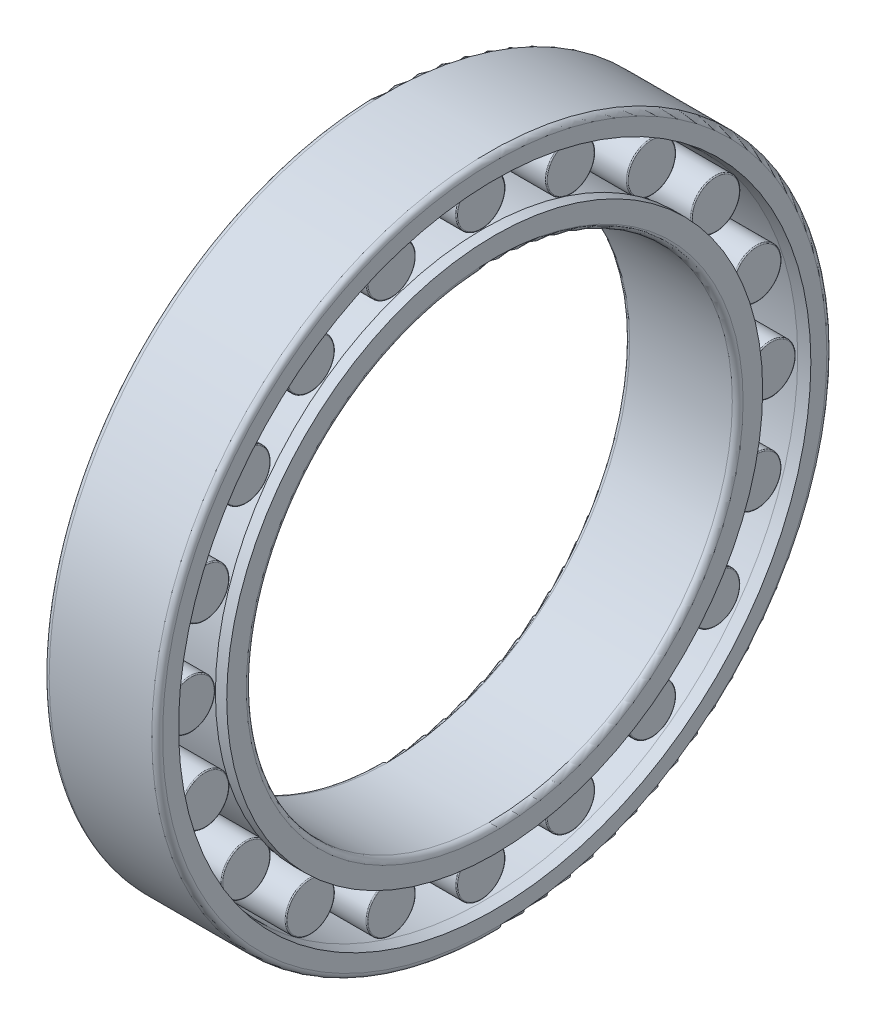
SolidWorks part; units mm, degrees
ref_plane "Plane1" through (0, 0, 0) normal (0, 0, 1) x (1, 0, 0)
ref_plane "Plane2" through (0, 0, 0) normal (0, 1, 0) x (1, 0, 0)
ref_plane "Plane3" through (0, 0, 0) normal (1, 0, 0) x (0, 0, -1)
other "Configuration Table"
sketch "Clipboard" plane through (0, 0, 0) normal (0, 0, 1) x (1, 0, 0)
  line L0 (-10, 0) -> (10, 0) construction
  line L1 (0, 0) -> (185.2698, -67.4327)
  line L2 (0, 0) -> (101.017, 36.7672)
  line L3 (0, 0) -> (218.798, -79.636)
  line L4 (0, 0) -> (-22.3471, -0.7804)
sketch "OutRacSke" plane through (0, 0, 0) normal (0, 0, 1) x (1, 0, 0)
  line L0 (16.8, 116.42) -> (21, 117.0867)
  line L1 (-21, 117.0867) -> (-21, 123)
  line L2 (-19, 125) -> (19, 125)
  line L3 (21, 123) -> (21, 117.0867)
  line L4 (-16.8, 116.42) -> (-21, 117.0867)
  line L6 (16.8, 116.42) -> (-16.8, 116.42)
  line L8 (-90, 0) -> (90, 0) construction
  arc A0 (-21, 123) -> (-19, 125) centre (-19, 123) cw
  arc A1 (19, 125) -> (21, 123) centre (19, 123) cw
revolve "OuterRace" add sketch "OutRacSke" angle 360 about L8
sketch "RolDetSke" plane through (0, 0, 0) normal (0, 0, 1) x (1, 0, 0)
  line L0 (-15.96, 116.1851) -> (-15.96, 107.5)
  line L1 (-15.96, 107.5) -> (15.96, 107.5)
  line L2 (15.96, 107.5) -> (15.96, 116.1851)
  line L3 (15.5981, 116.547) -> (-15.5981, 116.547)
  line L4 (-33.6, 107.5) -> (33.6, 107.5) construction
  arc A0 (15.96, 116.1851) -> (15.5981, 116.547) centre (15.5981, 116.1851) ccw
  arc A1 (-15.5981, 116.547) -> (-15.96, 116.1851) centre (-15.5981, 116.1851) ccw
revolve "RollerDetailed" add sketch "RolDetSke" angle 360 about L4
ref_axis "Axis1" through (-50, 0, 0) along (1, 0, 0)
sketch "RolSimSke" plane through (0, 101.6, 0) normal (0, 0, 1) x (1, 0, 0)
  line L0 (-15.96, 14.5851) -> (-15.96, -2.7851)
  line L1 (25.4, -101.6) -> (-25.4, -101.6) construction
  line L2 (15.96, -2.7851) -> (15.96, 14.5851)
  line L3 (15.5981, 14.947) -> (-15.5981, 14.947)
  line L5 (15.5981, -3.147) -> (-15.5981, -3.147)
  arc A0 (15.96, 14.5851) -> (15.5981, 14.947) centre (15.5981, 14.5851) ccw
  arc A1 (-15.5981, 14.947) -> (-15.96, 14.5851) centre (-15.5981, 14.5851) ccw
  arc A2 (15.96, -2.7851) -> (15.5981, -3.147) centre (15.5981, -2.7851) cw
  arc A3 (-15.5981, -3.147) -> (-15.96, -2.7851) centre (-15.5981, -2.7851) cw
revolve "RollersSimplified" [suppressed] add sketch "RolSimSke" angle 360 about L1
sketch "InsRacSke" plane through (0, 0, 0) normal (0, 0, 1) x (1, 0, 0)
  line L0 (16.8, 98.58) -> (16.8, 99.2467)
  line L1 (-21, 99.2467) -> (-21, 92)
  line L2 (-19, 90) -> (19, 90)
  line L3 (21, 92) -> (21, 99.2467)
  line L4 (16.8, 99.2467) -> (21, 99.2467)
  line L5 (16.8, 98.58) -> (-16.8, 98.58)
  line L6 (-90, 0) -> (90, 0) construction
  line L8 (-16.8, 98.58) -> (-16.8, 99.2467)
  line L9 (-16.8, 99.2467) -> (-21, 99.2467)
  arc A0 (-21, 92) -> (-19, 90) centre (-19, 92) ccw
  arc A1 (19, 90) -> (21, 92) centre (19, 92) ccw
revolve "InnerRace" add sketch "InsRacSke" angle 360 about L6
pattern_circular "RollersDetailed" count 20 every 18 about axis through (-50, 0, 0) along (1, 0, 0) of "RollerDetailed"
sketch "CagSpiSke" plane through (0, 0, 0) normal (0, 0, 1) x (1, 0, 0)
  line L0 (18.9, 105.2383) -> (18.9, 109.7618)
  line L1 (18.9, 109.7618) -> (-18.9, 109.7618)
  line L2 (-18.9, 109.7618) -> (-18.9, 105.2383)
  line L3 (-18.9, 105.2383) -> (18.9, 105.2383)
  line L4 (-90, 0) -> (90, 0) construction
revolve "CageSpine" [suppressed] add sketch "CagSpiSke" angle 360 about L4
equation "\"CLdia@Clipboard\" =  ( \"Race_OD@Clipboard\" + \"Race_ID@Clipboard\" )  / 4"
equation "\"Race_OD@OutRacSke\" = \"Race_OD@Clipboard\""
equation "\"halfCylLen@OutRacSke\" = \"Cyl_Len@OutRacSke\" / 2"
equation "\"groove_dp@OutRacSke\" = \"radius@OutRacSke\" / 3"
equation "\"RolCLRad@RolDetSke\" = \"CLdia@Clipboard\""
equation "\"Roller_diameter@RolDetSke\" =  ( \"Race_OD@Clipboard\" - \"Race_ID@Clipboard\" )  / 2 + .01"
equation "\"Roller_diameter@RolSimSke\" =  ( \"Race_OD@Clipboard\" - \"Race_ID@Clipboard\" )  / 2 + .01"
equation "\"radius@RolDetSke\" = \"Roller_diameter@RolDetSke\" / 50"
equation "\"Length@RolDetSke\" = \"Cyl_Len@OutRacSke\" * .95"
equation "\"halfLength@RolDetSke\" = \"Length@RolDetSke\" / 2"
equation "\"thickness@CagSpiSke\"  = \"Roller_diameter@RolDetSke\" * .25"
equation "\"Cag_IR@CagSpiSke\" =  \"RolCLRad@RolDetSke\" * 2 - \"thickness@CagSpiSke\""
equation "\"Rol_Length@RolSimSke\" = \"Cyl_Len@InsRacSke\" * .95"
equation "\"halfLength@RolSimSke\" = \"Rol_Length@RolSimSke\" / 2"
equation "\"radius@RolSimSke\" = \"radius@RolDetSke\""
equation "\"D1@RolSimSke\" = \"CLdia@Clipboard\" -  ( \"Roller_diameter@RolSimSke\" / 2 ) "
equation "\"Max_count@Clipboard\" = int( 3.14159265 / atn(( \"Roller_diameter@RolDetSke\" / 2) / sqr( \"RolCLRad@RolDetSke\"  *  \"RolCLRad@RolDetSke\" - ( \"Roller_diameter@RolDetSke\" / 2) *  ( \"Roller_diameter@RolDetS"
equation "\"Max_count@Clipboard\" = ((sgn( \"Max_count@Clipboard\" - \"Count@Clipboard\" )-1)*( \"Max_count@Clipboard\" - \"Count@Clipboard\" ))/-2+ \"Count@Clipboard\""
equation "\"Count@RollersDetailed\" = int( \"Show_count@Clipboard\" ) "
equation "\"Count@RollersDetailed\" = ((sgn( \"Count@RollersDetailed\" - \"Max_count@Clipboard\" )-1)*( \"Count@RollersDetailed\" - \"Max_count@Clipboard\" ))/-2+ \"Max_count@Clipboard\""
equation "\"Count@RollersDetailed\" = ((sgn( \"Count@RollersDetailed\" - \"Min_count@Clipboard\" )+1)*( \"Count@RollersDetailed\" - \"Min_count@Clipboard\"))/2 +\"Min_count@Clipboard\""
equation "\"Angle@RollersDetailed\" = 360.0 / \"Max_count@Clipboard\""
equation "\"radius@InsRacSke\" = \"radius@OutRacSke\""
equation "\"Width@InsRacSke\" = \"Width@OutRacSke\""
equation "\"halfWidth@OutRacSke\" = \"Width@OutRacSke\" / 2"
equation "\"halfWidth@InsRacSke\" = \"Width@InsRacSke\" / 2"
equation "\"Race_ID@InsRacSke\" = \"Race_ID@Clipboard\""
equation "\"Cyl_Len@InsRacSke\" = \"Cyl_Len@OutRacSke\""
equation "\"halfCylLen@InsRacSke\" = \"Cyl_Len@InsRacSke\" / 2"
equation "\"Angle@CageSpine\" =  \"Angle@RollersDetailed\" * ( \"Count@RollersDetailed\" -1 + int( \"Count@RollersDetailed\" / \"Max_count@Clipboard\" ) )  + 0.001 -  int( \"Count@RollersDetailed\" / \"Max_count@Clipboard\" "
equation "\"Angle@CageSpine\" =  \"Angle@CageSpine\" * int( \"Min_count@Clipboard\" / 2) + int(1 / \"Min_count@Clipboard\")  * 0.001"
equation "\"width@CagSpiSke\" =   ( \"Width@InsRacSke\" + \"Cyl_Len@InsRacSke\" )  / 2"
equation "\"halfwidth@CagSpiSke\" = \"width@CagSpiSke\" / 2"
